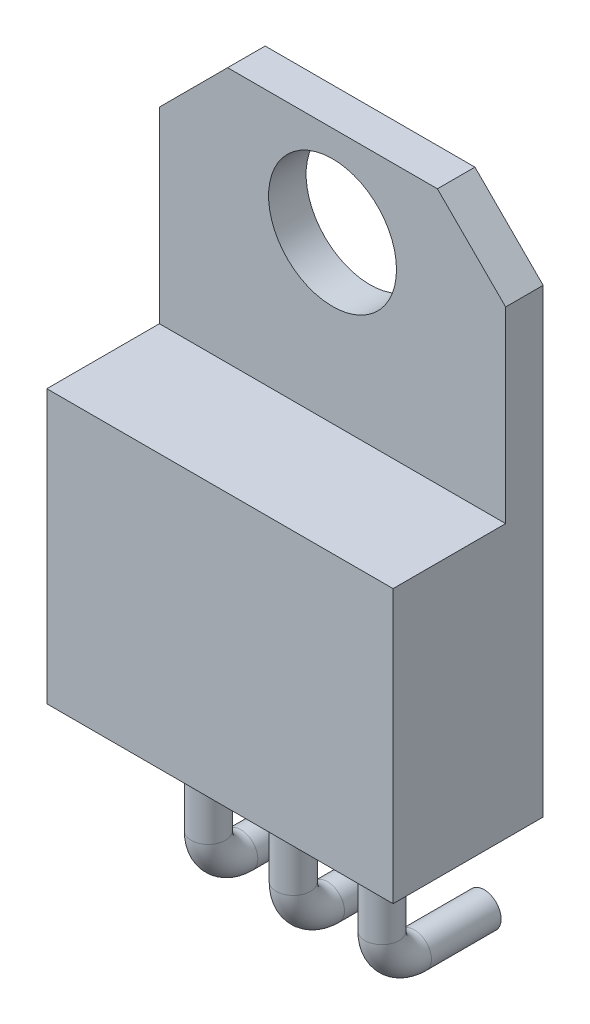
SolidWorks part; units mm, degrees
ref_plane "Face" through (0, 0, 0) normal (0, 0, 1) x (1, 0, 0)
ref_plane "Dessus" through (0, 0, 0) normal (0, 1, 0) x (1, 0, 0)
ref_plane "Droite" through (0, 0, 0) normal (1, 0, 0) x (0, 0, -1)
sketch "Esquisse1" plane through (0, 0, 0) normal (0, 0, 1) x (1, 0, 0)
  line L1 (0, 0) -> (10.15, 0)
  line L2 (0, 0) -> (0, 15.5)
  line L3 (0, 15.5) -> (10.15, 15.5)
  line L4 (10.15, 0) -> (10.15, 15.5)
  dimension "D1" = 10.15
  dimension "D2" = 15.5
extrude "Extrusion1" add sketch "Esquisse1" along normal blind 1.1
sketch "Esquisse2" plane through (0, 0, 1.1) normal (0, 0, 1) x (1, 0, 0)
  line L0 (5.075, 15.5) -> (5.075, 0) construction
  line L1 (10.15, 15.5) -> (0, 15.5) construction
  line L2 (0, 0) -> (10.15, 0) construction
  circle A0 centre (5.075, 12.85) radius 1.875
  dimension "D1" = 3.75
  dimension "D2" = 2.65
extrude "Enlèv. mat.-Extru.1" cut sketch "Esquisse2" against normal through all
chamfer "Chanfrein1" distance 2 angle 45 2 edges at (10.15, 15.5, 0.55) (0, 15.5, 0.55)
sketch "Esquisse3" plane through (0, 0, 1.1) normal (0, 0, 1) x (1, 0, 0)
  line L0 (10.15, 0) -> (10.15, 13.5) construction
  line L1 (0, 0) -> (10.15, 0)
  line L2 (0, 0) -> (0, 8)
  line L3 (0, 8) -> (10.15, 8)
  line L4 (10.15, 0) -> (10.15, 8)
  dimension "D1" = 8
extrude "Extrusion2" add sketch "Esquisse3" along normal blind 3.3
sketch "Esquisse5" plane through (0, 0, 0) normal (0, -1, 0) x (1, 0, 0)
  line L0 (10.15, 2.2) -> (0, 2.2) construction
  line L1 (10.15, 4.4) -> (10.15, 0) construction
  line L2 (0, 4.4) -> (0, 0) construction
  line L3 (5.075, 4.4) -> (5.075, 0) construction
  line L4 (0, 4.4) -> (10.15, 4.4) construction
  line L5 (0, 0) -> (10.15, 0) construction
  circle A2 centre (2.535, 2.2) radius 0.5
ref_plane "Plan1" through (2.54, 0, 0) normal (1, 0, 0) x (0, 0, -1)
sketch "Esquisse8" plane through (2.54, 0, 0) normal (1, 0, 0) x (0, 0, -1)
  line L0 (0, -0.3289) -> (0, -5.6814) construction
  line L1 (1.1833, -4.05) -> (-3.597, -4.05) construction
  line L2 (1.1833, 0) -> (-3.2267, 0) construction
  line L3 (-2.25, 1.186) -> (-2.25, -5.6814) construction
  line L4 (-2.25, 0) -> (-2.25, -3.05)
  line L5 (-1.25, -4.05) -> (0.792, -4.05)
  arc A0 (-2.25, -3.05) -> (-1.25, -4.05) centre (-1.25, -3.05) ccw
  dimension "D3" = 1
  dimension "D1" = 2.25
  dimension "D2" = 4.05
sweep "Balayage1" add profiles "Esquisse5" path "Esquisse8"
sketch "Esquisse9" plane through (0, 0, 0) normal (0, -1, 0) x (1, 0, 0)
  line L0 (5.075, -0.3913) -> (5.075, 6.4257) construction
  line L1 (-2.5677, 0) -> (13.037, 0) construction
  line L2 (13.037, 2.25) -> (-3.6328, 2.25) construction
  circle A0 centre (5.075, 2.25) radius 0.5
  dimension "D1" = 2.25
ref_plane "Plan2" through (5.08, 0, 0) normal (1, 0, 0) x (0, 0, -1)
sketch "Esquisse10" plane through (5.08, 0, 0) normal (1, 0, 0) x (0, 0, -1)
  line L0 (0.792, -5.5725) -> (0.792, -2.1485) construction
  line L1 (1.4127, -4.05) -> (-3.8327, -4.05) construction
  line L2 (-2.25, 0.8142) -> (-2.25, -6.301) construction
  line L3 (-2.25, 0) -> (-2.25, -3.05)
  line L4 (-1.25, -4.05) -> (0.792, -4.05)
  arc A0 (-2.25, -3.05) -> (-1.25, -4.05) centre (-1.25, -3.05) ccw
  dimension "D1" = 1
sweep "Balayage2" add profiles "Esquisse9" path "Esquisse10"
mirror "Symétrie1" about plane through (5.08, 0, 0) normal (1, 0, 0) of "Balayage1"
